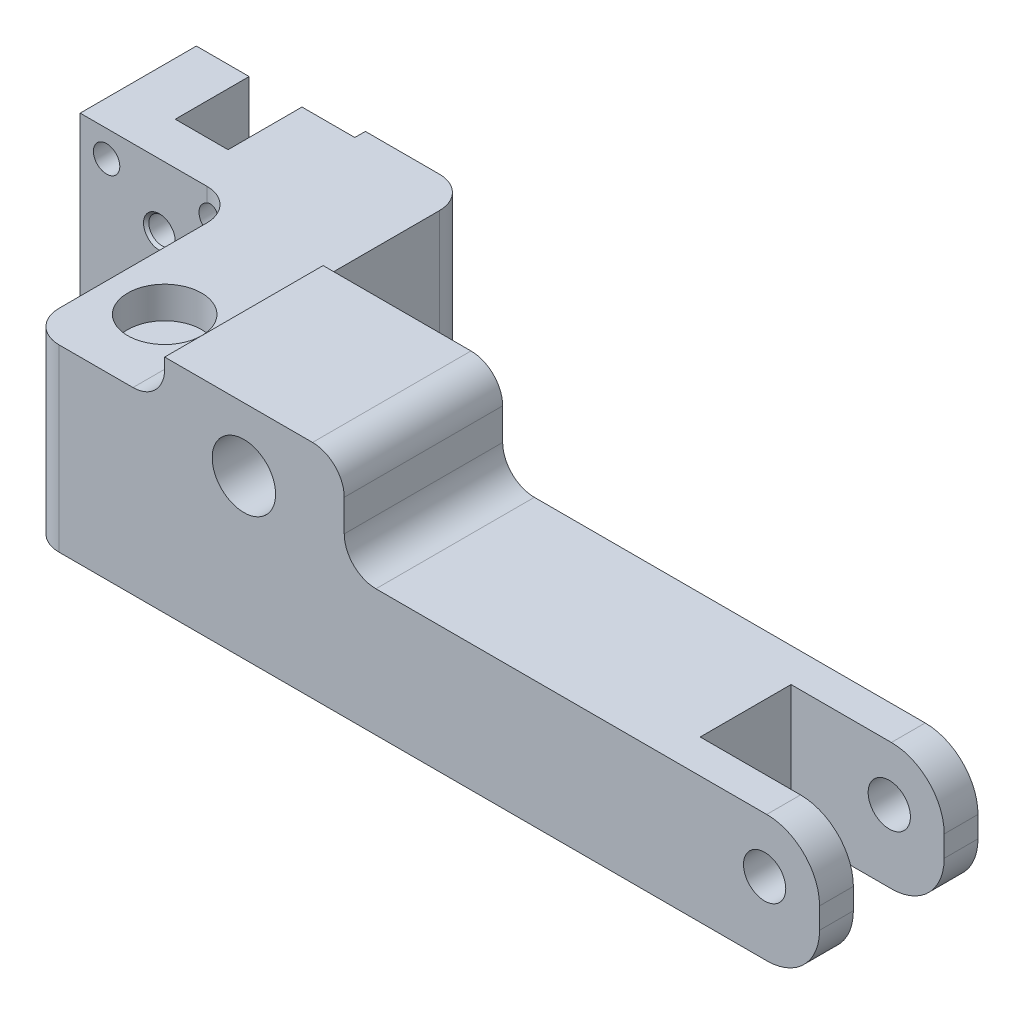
SolidWorks part; units mm, degrees
ref_plane "Face" through (0, 0, 0) normal (0, 0, 1) x (1, 0, 0)
ref_plane "Dessus" through (0, 0, 0) normal (0, 1, 0) x (1, 0, 0)
ref_plane "Profil" through (0, 0, 0) normal (1, 0, 0) x (0, 0, -1)
ref_plane "Face-Bras inferieur_Rendre symétrique" through (0, 30, 0) normal (0, 0, 1) x (1, 0, 0)
ref_plane "Dessus-Bras inferieur_Rendre symétrique" through (0, 30, 0) normal (0, -1, 0) x (1, 0, 0)
ref_plane "Profil-Bras inferieur_Rendre symétrique" through (0, 30, 0) normal (1, 0, 0) x (0, 0, -1)
ref_plane "Plan1-Bras inferieur_Rendre symétrique" through (0, 30, 8.5) normal (0, 0, 1) x (1, 0, 0)
ref_plane "Plan2-Bras inferieur_Rendre symétrique" through (-28, 30, 0) normal (-1, 0, 0) x (0, 0, 1)
mirrored part "Bras inferieur_Rendre symétrique"
other "<Bras inferieur>-<Enlèv. mat.-Extru.10>"
